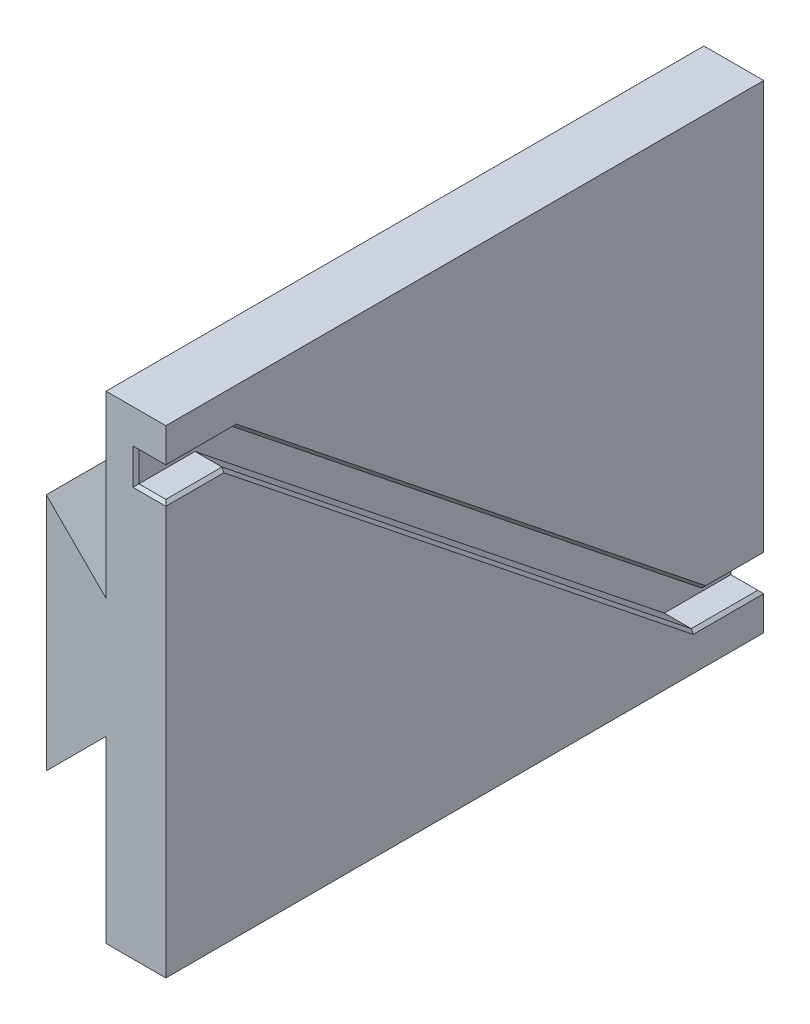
SolidWorks part; units mm, degrees
ref_plane "Front Plane" through (0, 0, 0) normal (0, 0, 1) x (1, 0, 0)
ref_plane "Top Plane" through (0, 0, 0) normal (0, 1, 0) x (1, 0, 0)
ref_plane "Right Plane" through (0, 0, 0) normal (1, 0, 0) x (0, 0, -1)
sketch "Sketch1" plane through (0, 0, 0) normal (0, 0, 1) x (1, 0, 0)
  line L1 (0, 80) -> (-20, 80)
  line L2 (0, 80) -> (0, -80)
  line L3 (0, -80) -> (-20, -80)
  line L4 (-20, 80) -> (-20, 20)
  line L5 (-20, 20) -> (-40, 40)
  line L6 (-40, 40) -> (-40, -40)
  line L7 (-40, 0) -> (-20, 0) construction
  line L8 (-20, -20) -> (-40, -40)
  line L9 (-20, -20) -> (-20, -80)
  point P4 (0, 0)
  dimension "D1" = 20
  dimension "D2" = 160
  dimension "D3" = 45
  dimension "D4" = 20
  dimension "D5" = 20
extrude "Boss-Extrude1" add sketch "Sketch1" along normal mid plane 200
sketch "Sketch2" plane through (0, 0, 0) normal (1, 0, 0) x (0, 0, -1)
  line L0 (0, 80) -> (0, -80) construction
  line L1 (-100, 80) -> (100, 80) construction
  line L2 (-100, -80) -> (100, -80) construction
  line L3 (-100, 62.6602) -> (-78.5, 62.6602) construction
  line L4 (-100, -80) -> (-100, 80) construction
  line L5 (-78.5, 62.6602) -> (78.5, -62.6602) construction
  line L6 (78.5, -62.6602) -> (100, -62.6602) construction
  line L7 (100, -80) -> (100, 80) construction
  line L8 (-100, 57.6602) -> (-80.2509, 57.6602)
  line L9 (-80.2509, 57.6602) -> (76.7491, -67.6602)
  line L10 (76.7491, -67.6602) -> (100, -67.6602)
  line L11 (-100, 67.6602) -> (-76.7491, 67.6602)
  line L12 (-76.7491, 67.6602) -> (80.2509, -57.6602)
  line L13 (80.2509, -57.6602) -> (100, -57.6602)
  line L14 (-100, 67.6602) -> (-100, 57.6602)
  line L15 (100, -57.6602) -> (100, -67.6602)
  point P10 (0, 0)
  dimension "D1" = 157
  dimension "D2" = 78.5
  dimension "D3" = 5
  dimension "D4" = 5
extrude "Cut-Extrude1" cut sketch "Sketch2" against normal blind 10
chamfer "Chamfer1" distance 1 angle 45 12 edges at (-5, -67.6602, -100) (-10, -62.6602, -100) (-5, -57.6602, -100) (0, -67.6602, -88.3746) (0, -57.6602, -90.1254) (0, -5, 1.7509) (0, 57.6602, 90.1254) (-5, 57.6602, 100) (-10, 62.6602, 100) (-5, 67.6602, 100) (0, 67.6602, 88.3746) (0, 5, -1.7509)
